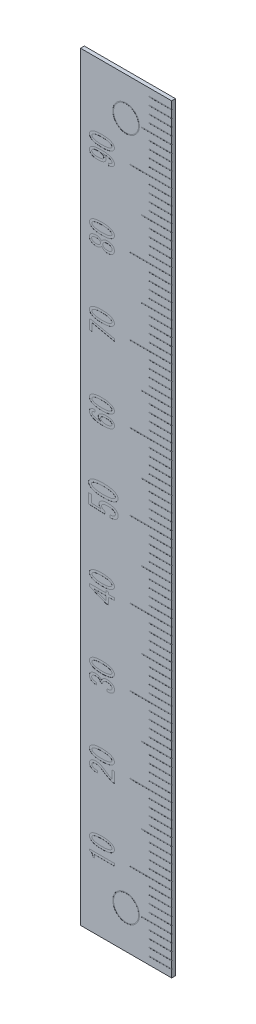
SolidWorks part; units mm, degrees
ref_plane "Front" through (0, 0, 0) normal (0, 0, 1) x (1, 0, 0)
ref_plane "Top" through (0, 0, 0) normal (0, 1, 0) x (1, 0, 0)
ref_plane "Right" through (0, 0, 0) normal (1, 0, 0) x (0, 0, -1)
sketch "Sketch1" plane through (0, 0, 0) normal (0, 0, 1) x (1, 0, 0)
  line L1 (0, 0) -> (0, 100)
  line L2 (0, 0) -> (12, 0)
  line L3 (12, 0) -> (12, 100)
  line L4 (0, 100) -> (12, 100)
  dimension "D1" = 100
  dimension "D2" = 12
extrude "Extrude1" add sketch "Sketch1" along normal blind 0.5
sketch "Sketch2" plane through (0, 0, 0.5) normal (0, 0, 1) x (1, 0, 0)
  line L0 (0, 100) -> (0, 0) construction
  line L1 (0, 0) -> (12, 0) construction
  line L2 (12, 100) -> (0, 100) construction
  circle A0 centre (6, 5) radius 1.75
  circle A1 centre (6, 95) radius 1.75
  circle A2 centre (6, 5) radius 1.65
  circle A3 centre (6, 95) radius 1.65
  dimension "D1" = 6
  dimension "D2" = 6
  dimension "D3" = 5
  dimension "D4" = 5
  dimension "D5" = 3.5
  dimension "D6" = 3.5
  dimension "D7" = 0.1
extrude "Extrude2" cut sketch "Sketch2" against normal blind 0.01
sketch "Sketch3" plane through (0, 0, 0.5) normal (0, 0, 1) x (1, 0, 0)
  line L0 (12, 100) -> (0, 100) construction
  line L1 (1, 88.25) -> (4.5, 88.25) construction
  line L2 (1, 88.25) -> (1, 91.75) construction
  line L3 (1, 91.75) -> (4.5, 91.75) construction
  line L4 (4.5, 88.25) -> (4.5, 91.75) construction
  line L5 (0, 100) -> (0, 0) construction
  line L6 (4.5, 78.25) -> (4.5, 81.75) construction
  line L7 (4.5, 68.25) -> (4.5, 71.75) construction
  line L8 (4.5, 58.25) -> (4.5, 61.75) construction
  line L9 (5, 48.25) -> (5, 51.75) construction
  line L10 (4.5, 38.25) -> (4.5, 41.75) construction
  line L11 (4.5, 28.25) -> (4.5, 31.75) construction
  line L12 (4.5, 18.25) -> (4.5, 21.75) construction
  line L13 (4.5, 8.25) -> (4.5, 11.75) construction
  line L14 (12, 0) -> (12, 100) construction
  text T0 "90" font "ＭＳ ゴシック" height in points 11
  text T1 "80  " font "ＭＳ ゴシック" height in points 11
  text T2 "70" font "ＭＳ ゴシック" height in points 11
  text T3 "60" font "ＭＳ ゴシック" height in points 11
  text T4 "50" font "ＭＳ ゴシック" height in points 13
  text T5 "40  " font "ＭＳ ゴシック" height in points 11
  text T6 "30" font "ＭＳ ゴシック" height in points 11
  text T7 "20" font "ＭＳ ゴシック" height in points 11
  text T8 "10" font "ＭＳ ゴシック" height in points 11
  point P4 (4.5, 90)
  dimension "D1" = 3.5
  dimension "D2" = 10
  dimension "D3" = 1
  dimension "D4" = 3.5
  dimension "D6" = 7
  dimension "D5" = 4
extrude "Extrude3" cut sketch "Sketch3" against normal blind 0.01
sketch "Sketch4" plane through (0, 0, 0.5) normal (0, 0, 1) x (1, 0, 0)
  line L0 (12, 90.05) -> (6.5, 90.05)
  line L1 (12, 0) -> (12, 100) construction
  line L2 (6.5, 90.05) -> (6.5, 89.95)
  line L3 (6.5, 89.95) -> (12, 89.95)
  line L4 (12, 89.95) -> (12, 90.05)
  line L5 (12, 100) -> (0, 100) construction
  line L6 (12, 98.05) -> (12, 97.95)
  line L7 (12, 94.95) -> (8, 94.95)
  line L8 (12, 94.95) -> (12, 95.05)
  line L9 (12, 95.05) -> (8, 95.05)
  line L10 (8, 94.95) -> (8, 95.05)
  line L11 (12, 99.05) -> (9, 99.05)
  line L12 (12, 99.05) -> (12, 98.95)
  line L13 (12, 98.95) -> (9, 98.95)
  line L14 (9, 99.05) -> (9, 98.95)
  line L15 (12, 98.05) -> (9, 98.05)
  line L16 (12, 97.95) -> (9, 97.95)
  line L17 (9, 98.05) -> (9, 97.95)
  line L18 (12, 97.05) -> (12, 96.95)
  line L19 (12, 97.05) -> (9, 97.05)
  line L20 (12, 96.95) -> (9, 96.95)
  line L21 (9, 97.05) -> (9, 96.95)
  line L22 (12, 96.05) -> (12, 95.95)
  line L23 (12, 96.05) -> (9, 96.05)
  line L24 (12, 95.95) -> (9, 95.95)
  line L25 (9, 96.05) -> (9, 95.95)
  line L26 (12, 80.05) -> (6.5, 80.05)
  line L27 (6.5, 80.05) -> (6.5, 79.95)
  line L28 (6.5, 79.95) -> (12, 79.95)
  line L29 (12, 79.95) -> (12, 80.05)
  line L30 (12, 94.05) -> (12, 93.95)
  line L31 (12, 94.05) -> (9, 94.05)
  line L32 (12, 93.95) -> (9, 93.95)
  line L33 (9, 94.05) -> (9, 93.95)
  line L34 (12, 93.05) -> (12, 92.95)
  line L35 (12, 93.05) -> (9, 93.05)
  line L36 (12, 92.95) -> (9, 92.95)
  line L37 (9, 93.05) -> (9, 92.95)
  line L38 (12, 92.05) -> (12, 91.95)
  line L39 (12, 92.05) -> (9, 92.05)
  line L40 (12, 91.95) -> (9, 91.95)
  line L41 (9, 92.05) -> (9, 91.95)
  line L42 (12, 91.05) -> (12, 90.95)
  line L43 (12, 91.05) -> (9, 91.05)
  line L44 (12, 90.95) -> (9, 90.95)
  line L45 (9, 91.05) -> (9, 90.95)
  line L46 (9, 95.05) -> (9, 94.95)
  line L47 (12, 95.05) -> (9, 95.05)
  line L48 (12, 94.95) -> (9, 94.95)
  line L49 (12, 95.05) -> (12, 94.95)
  line L50 (12, 88.05) -> (12, 87.95)
  line L51 (12, 84.95) -> (8, 84.95)
  line L52 (12, 84.95) -> (12, 85.05)
  line L53 (12, 85.05) -> (8, 85.05)
  line L54 (8, 84.95) -> (8, 85.05)
  line L55 (12, 89.05) -> (9, 89.05)
  line L56 (12, 89.05) -> (12, 88.95)
  line L57 (12, 88.95) -> (9, 88.95)
  line L58 (9, 89.05) -> (9, 88.95)
  line L59 (12, 88.05) -> (9, 88.05)
  line L60 (12, 87.95) -> (9, 87.95)
  line L61 (9, 88.05) -> (9, 87.95)
  line L62 (12, 87.05) -> (12, 86.95)
  line L63 (12, 87.05) -> (9, 87.05)
  line L64 (12, 86.95) -> (9, 86.95)
  line L65 (9, 87.05) -> (9, 86.95)
  line L66 (12, 86.05) -> (12, 85.95)
  line L67 (12, 86.05) -> (9, 86.05)
  line L68 (12, 85.95) -> (9, 85.95)
  line L69 (9, 86.05) -> (9, 85.95)
  line L70 (12, 84.05) -> (12, 83.95)
  line L71 (12, 84.05) -> (9, 84.05)
  line L72 (12, 83.95) -> (9, 83.95)
  line L73 (9, 84.05) -> (9, 83.95)
  line L74 (12, 83.05) -> (12, 82.95)
  line L75 (12, 83.05) -> (9, 83.05)
  line L76 (12, 82.95) -> (9, 82.95)
  line L77 (9, 83.05) -> (9, 82.95)
  line L78 (12, 82.05) -> (12, 81.95)
  line L79 (12, 82.05) -> (9, 82.05)
  line L80 (12, 81.95) -> (9, 81.95)
  line L81 (9, 82.05) -> (9, 81.95)
  line L82 (12, 81.05) -> (12, 80.95)
  line L83 (12, 81.05) -> (9, 81.05)
  line L84 (12, 80.95) -> (9, 80.95)
  line L85 (9, 81.05) -> (9, 80.95)
  line L86 (12, 70.05) -> (6.5, 70.05)
  line L87 (6.5, 70.05) -> (6.5, 69.95)
  line L88 (6.5, 69.95) -> (12, 69.95)
  line L89 (12, 69.95) -> (12, 70.05)
  line L90 (12, 78.05) -> (12, 77.95)
  line L91 (12, 74.95) -> (8, 74.95)
  line L92 (12, 74.95) -> (12, 75.05)
  line L93 (12, 75.05) -> (8, 75.05)
  line L94 (8, 74.95) -> (8, 75.05)
  line L95 (12, 79.05) -> (9, 79.05)
  line L96 (12, 79.05) -> (12, 78.95)
  line L97 (12, 78.95) -> (9, 78.95)
  line L98 (9, 79.05) -> (9, 78.95)
  line L99 (12, 78.05) -> (9, 78.05)
  line L100 (12, 77.95) -> (9, 77.95)
  line L101 (9, 78.05) -> (9, 77.95)
  line L102 (12, 77.05) -> (12, 76.95)
  line L103 (12, 77.05) -> (9, 77.05)
  line L104 (12, 76.95) -> (9, 76.95)
  line L105 (9, 77.05) -> (9, 76.95)
  line L106 (12, 76.05) -> (12, 75.95)
  line L107 (12, 76.05) -> (9, 76.05)
  line L108 (12, 75.95) -> (9, 75.95)
  line L109 (9, 76.05) -> (9, 75.95)
  line L110 (12, 74.05) -> (12, 73.95)
  line L111 (12, 74.05) -> (9, 74.05)
  line L112 (12, 73.95) -> (9, 73.95)
  line L113 (9, 74.05) -> (9, 73.95)
  line L114 (12, 73.05) -> (12, 72.95)
  line L115 (12, 73.05) -> (9, 73.05)
  line L116 (12, 72.95) -> (9, 72.95)
  line L117 (9, 73.05) -> (9, 72.95)
  line L118 (12, 72.05) -> (12, 71.95)
  line L119 (12, 72.05) -> (9, 72.05)
  line L120 (12, 71.95) -> (9, 71.95)
  line L121 (9, 72.05) -> (9, 71.95)
  line L122 (12, 71.05) -> (12, 70.95)
  line L123 (12, 71.05) -> (9, 71.05)
  line L124 (12, 70.95) -> (9, 70.95)
  line L125 (9, 71.05) -> (9, 70.95)
  line L126 (12, 60.05) -> (6.5, 60.05)
  line L127 (6.5, 60.05) -> (6.5, 59.95)
  line L128 (6.5, 59.95) -> (12, 59.95)
  line L129 (12, 59.95) -> (12, 60.05)
  line L130 (12, 68.05) -> (12, 67.95)
  line L131 (12, 64.95) -> (8, 64.95)
  line L132 (12, 64.95) -> (12, 65.05)
  line L133 (12, 65.05) -> (8, 65.05)
  line L134 (8, 64.95) -> (8, 65.05)
  line L135 (12, 69.05) -> (9, 69.05)
  line L136 (12, 69.05) -> (12, 68.95)
  line L137 (12, 68.95) -> (9, 68.95)
  line L138 (9, 69.05) -> (9, 68.95)
  line L139 (12, 68.05) -> (9, 68.05)
  line L140 (12, 67.95) -> (9, 67.95)
  line L141 (9, 68.05) -> (9, 67.95)
  line L142 (12, 67.05) -> (12, 66.95)
  line L143 (12, 67.05) -> (9, 67.05)
  line L144 (12, 66.95) -> (9, 66.95)
  line L145 (9, 67.05) -> (9, 66.95)
  line L146 (12, 66.05) -> (12, 65.95)
  line L147 (12, 66.05) -> (9, 66.05)
  line L148 (12, 65.95) -> (9, 65.95)
  line L149 (9, 66.05) -> (9, 65.95)
  line L150 (12, 64.05) -> (12, 63.95)
  line L151 (12, 64.05) -> (9, 64.05)
  line L152 (12, 63.95) -> (9, 63.95)
  line L153 (9, 64.05) -> (9, 63.95)
  line L154 (12, 63.05) -> (12, 62.95)
  line L155 (12, 63.05) -> (9, 63.05)
  line L156 (12, 62.95) -> (9, 62.95)
  line L157 (9, 63.05) -> (9, 62.95)
  line L158 (12, 62.05) -> (12, 61.95)
  line L159 (12, 62.05) -> (9, 62.05)
  line L160 (12, 61.95) -> (9, 61.95)
  line L161 (9, 62.05) -> (9, 61.95)
  line L162 (12, 61.05) -> (12, 60.95)
  line L163 (12, 61.05) -> (9, 61.05)
  line L164 (12, 60.95) -> (9, 60.95)
  line L165 (9, 61.05) -> (9, 60.95)
  line L166 (12, 50.05) -> (6.5, 50.05)
  line L167 (6.5, 50.05) -> (6.5, 49.95)
  line L168 (6.5, 49.95) -> (12, 49.95)
  line L169 (12, 49.95) -> (12, 50.05)
  line L170 (12, 58.05) -> (12, 57.95)
  line L171 (12, 54.95) -> (8, 54.95)
  line L172 (12, 54.95) -> (12, 55.05)
  line L173 (12, 55.05) -> (8, 55.05)
  line L174 (8, 54.95) -> (8, 55.05)
  line L175 (12, 59.05) -> (9, 59.05)
  line L176 (12, 59.05) -> (12, 58.95)
  line L177 (12, 58.95) -> (9, 58.95)
  line L178 (9, 59.05) -> (9, 58.95)
  line L179 (12, 58.05) -> (9, 58.05)
  line L180 (12, 57.95) -> (9, 57.95)
  line L181 (9, 58.05) -> (9, 57.95)
  line L182 (12, 57.05) -> (12, 56.95)
  line L183 (12, 57.05) -> (9, 57.05)
  line L184 (12, 56.95) -> (9, 56.95)
  line L185 (9, 57.05) -> (9, 56.95)
  line L186 (12, 56.05) -> (12, 55.95)
  line L187 (12, 56.05) -> (9, 56.05)
  line L188 (12, 55.95) -> (9, 55.95)
  line L189 (9, 56.05) -> (9, 55.95)
  line L190 (12, 54.05) -> (12, 53.95)
  line L191 (12, 54.05) -> (9, 54.05)
  line L192 (12, 53.95) -> (9, 53.95)
  line L193 (9, 54.05) -> (9, 53.95)
  line L194 (12, 53.05) -> (12, 52.95)
  line L195 (12, 53.05) -> (9, 53.05)
  line L196 (12, 52.95) -> (9, 52.95)
  line L197 (9, 53.05) -> (9, 52.95)
  line L198 (12, 52.05) -> (12, 51.95)
  line L199 (12, 52.05) -> (9, 52.05)
  line L200 (12, 51.95) -> (9, 51.95)
  line L201 (9, 52.05) -> (9, 51.95)
  line L202 (12, 51.05) -> (12, 50.95)
  line L203 (12, 51.05) -> (9, 51.05)
  line L204 (12, 50.95) -> (9, 50.95)
  line L205 (9, 51.05) -> (9, 50.95)
  line L206 (12, 50.05) -> (6.5, 50.05)
  line L207 (6.5, 50.05) -> (6.5, 49.95)
  line L208 (6.5, 49.95) -> (12, 49.95)
  line L209 (12, 49.95) -> (12, 50.05)
  line L210 (12, 48.05) -> (12, 47.95)
  line L211 (12, 44.95) -> (8, 44.95)
  line L212 (12, 44.95) -> (12, 45.05)
  line L213 (12, 45.05) -> (8, 45.05)
  line L214 (8, 44.95) -> (8, 45.05)
  line L215 (12, 49.05) -> (9, 49.05)
  line L216 (12, 49.05) -> (12, 48.95)
  line L217 (12, 48.95) -> (9, 48.95)
  line L218 (9, 49.05) -> (9, 48.95)
  line L219 (12, 48.05) -> (9, 48.05)
  line L220 (12, 47.95) -> (9, 47.95)
  line L221 (9, 48.05) -> (9, 47.95)
  line L222 (12, 47.05) -> (12, 46.95)
  line L223 (12, 47.05) -> (9, 47.05)
  line L224 (12, 46.95) -> (9, 46.95)
  line L225 (9, 47.05) -> (9, 46.95)
  line L226 (12, 46.05) -> (12, 45.95)
  line L227 (12, 46.05) -> (9, 46.05)
  line L228 (12, 45.95) -> (9, 45.95)
  line L229 (9, 46.05) -> (9, 45.95)
  line L230 (12, 44.05) -> (12, 43.95)
  line L231 (12, 44.05) -> (9, 44.05)
  line L232 (12, 43.95) -> (9, 43.95)
  line L233 (9, 44.05) -> (9, 43.95)
  line L234 (12, 43.05) -> (12, 42.95)
  line L235 (12, 43.05) -> (9, 43.05)
  line L236 (12, 42.95) -> (9, 42.95)
  line L237 (9, 43.05) -> (9, 42.95)
  line L238 (12, 42.05) -> (12, 41.95)
  line L239 (12, 42.05) -> (9, 42.05)
  line L240 (12, 41.95) -> (9, 41.95)
  line L241 (9, 42.05) -> (9, 41.95)
  line L242 (12, 41.05) -> (12, 40.95)
  line L243 (12, 41.05) -> (9, 41.05)
  line L244 (12, 40.95) -> (9, 40.95)
  line L245 (9, 41.05) -> (9, 40.95)
  line L246 (12, 40.05) -> (6.5, 40.05)
  line L247 (6.5, 40.05) -> (6.5, 39.95)
  line L248 (6.5, 39.95) -> (12, 39.95)
  line L249 (12, 39.95) -> (12, 40.05)
  line L250 (12, 38.05) -> (12, 37.95)
  line L251 (12, 34.95) -> (8, 34.95)
  line L252 (12, 34.95) -> (12, 35.05)
  line L253 (12, 35.05) -> (8, 35.05)
  line L254 (8, 34.95) -> (8, 35.05)
  line L255 (12, 39.05) -> (9, 39.05)
  line L256 (12, 39.05) -> (12, 38.95)
  line L257 (12, 38.95) -> (9, 38.95)
  line L258 (9, 39.05) -> (9, 38.95)
  line L259 (12, 38.05) -> (9, 38.05)
  line L260 (12, 37.95) -> (9, 37.95)
  line L261 (9, 38.05) -> (9, 37.95)
  line L262 (12, 37.05) -> (12, 36.95)
  line L263 (12, 37.05) -> (9, 37.05)
  line L264 (12, 36.95) -> (9, 36.95)
  line L265 (9, 37.05) -> (9, 36.95)
  line L266 (12, 36.05) -> (12, 35.95)
  line L267 (12, 36.05) -> (9, 36.05)
  line L268 (12, 35.95) -> (9, 35.95)
  line L269 (9, 36.05) -> (9, 35.95)
  line L270 (12, 34.05) -> (12, 33.95)
  line L271 (12, 34.05) -> (9, 34.05)
  line L272 (12, 33.95) -> (9, 33.95)
  line L273 (9, 34.05) -> (9, 33.95)
  line L274 (12, 33.05) -> (12, 32.95)
  line L275 (12, 33.05) -> (9, 33.05)
  line L276 (12, 32.95) -> (9, 32.95)
  line L277 (9, 33.05) -> (9, 32.95)
  line L278 (12, 32.05) -> (12, 31.95)
  line L279 (12, 32.05) -> (9, 32.05)
  line L280 (12, 31.95) -> (9, 31.95)
  line L281 (9, 32.05) -> (9, 31.95)
  line L282 (12, 31.05) -> (12, 30.95)
  line L283 (12, 31.05) -> (9, 31.05)
  line L284 (12, 30.95) -> (9, 30.95)
  line L285 (9, 31.05) -> (9, 30.95)
  line L286 (12, 30.05) -> (6.5, 30.05)
  line L287 (6.5, 30.05) -> (6.5, 29.95)
  line L288 (6.5, 29.95) -> (12, 29.95)
  line L289 (12, 29.95) -> (12, 30.05)
  line L290 (12, 28.05) -> (12, 27.95)
  line L291 (12, 24.95) -> (8, 24.95)
  line L292 (12, 24.95) -> (12, 25.05)
  line L293 (12, 25.05) -> (8, 25.05)
  line L294 (8, 24.95) -> (8, 25.05)
  line L295 (12, 29.05) -> (9, 29.05)
  line L296 (12, 29.05) -> (12, 28.95)
  line L297 (12, 28.95) -> (9, 28.95)
  line L298 (9, 29.05) -> (9, 28.95)
  line L299 (12, 28.05) -> (9, 28.05)
  line L300 (12, 27.95) -> (9, 27.95)
  line L301 (9, 28.05) -> (9, 27.95)
  line L302 (12, 27.05) -> (12, 26.95)
  line L303 (12, 27.05) -> (9, 27.05)
  line L304 (12, 26.95) -> (9, 26.95)
  line L305 (9, 27.05) -> (9, 26.95)
  line L306 (12, 26.05) -> (12, 25.95)
  line L307 (12, 26.05) -> (9, 26.05)
  line L308 (12, 25.95) -> (9, 25.95)
  line L309 (9, 26.05) -> (9, 25.95)
  line L310 (12, 24.05) -> (12, 23.95)
  line L311 (12, 24.05) -> (9, 24.05)
  line L312 (12, 23.95) -> (9, 23.95)
  line L313 (9, 24.05) -> (9, 23.95)
  line L314 (12, 23.05) -> (12, 22.95)
  line L315 (12, 23.05) -> (9, 23.05)
  line L316 (12, 22.95) -> (9, 22.95)
  line L317 (9, 23.05) -> (9, 22.95)
  line L318 (12, 22.05) -> (12, 21.95)
  line L319 (12, 22.05) -> (9, 22.05)
  line L320 (12, 21.95) -> (9, 21.95)
  line L321 (9, 22.05) -> (9, 21.95)
  line L322 (12, 21.05) -> (12, 20.95)
  line L323 (12, 21.05) -> (9, 21.05)
  line L324 (12, 20.95) -> (9, 20.95)
  line L325 (9, 21.05) -> (9, 20.95)
  line L326 (12, 20.05) -> (6.5, 20.05)
  line L327 (6.5, 20.05) -> (6.5, 19.95)
  line L328 (6.5, 19.95) -> (12, 19.95)
  line L329 (12, 19.95) -> (12, 20.05)
  line L330 (12, 18.05) -> (12, 17.95)
  line L331 (12, 14.95) -> (8, 14.95)
  line L332 (12, 14.95) -> (12, 15.05)
  line L333 (12, 15.05) -> (8, 15.05)
  line L334 (8, 14.95) -> (8, 15.05)
  line L335 (12, 19.05) -> (9, 19.05)
  line L336 (12, 19.05) -> (12, 18.95)
  line L337 (12, 18.95) -> (9, 18.95)
  line L338 (9, 19.05) -> (9, 18.95)
  line L339 (12, 18.05) -> (9, 18.05)
  line L340 (12, 17.95) -> (9, 17.95)
  line L341 (9, 18.05) -> (9, 17.95)
  line L342 (12, 17.05) -> (12, 16.95)
  line L343 (12, 17.05) -> (9, 17.05)
  line L344 (12, 16.95) -> (9, 16.95)
  line L345 (9, 17.05) -> (9, 16.95)
  line L346 (12, 16.05) -> (12, 15.95)
  line L347 (12, 16.05) -> (9, 16.05)
  line L348 (12, 15.95) -> (9, 15.95)
  line L349 (9, 16.05) -> (9, 15.95)
  line L350 (12, 14.05) -> (12, 13.95)
  line L351 (12, 14.05) -> (9, 14.05)
  line L352 (12, 13.95) -> (9, 13.95)
  line L353 (9, 14.05) -> (9, 13.95)
  line L354 (12, 13.05) -> (12, 12.95)
  line L355 (12, 13.05) -> (9, 13.05)
  line L356 (12, 12.95) -> (9, 12.95)
  line L357 (9, 13.05) -> (9, 12.95)
  line L358 (12, 12.05) -> (12, 11.95)
  line L359 (12, 12.05) -> (9, 12.05)
  line L360 (12, 11.95) -> (9, 11.95)
  line L361 (9, 12.05) -> (9, 11.95)
  line L362 (12, 11.05) -> (12, 10.95)
  line L363 (12, 11.05) -> (9, 11.05)
  line L364 (12, 10.95) -> (9, 10.95)
  line L365 (9, 11.05) -> (9, 10.95)
  line L366 (12, 10.05) -> (6.5, 10.05)
  line L367 (6.5, 10.05) -> (6.5, 9.95)
  line L368 (6.5, 9.95) -> (12, 9.95)
  line L369 (12, 9.95) -> (12, 10.05)
  line L370 (12, 8.05) -> (12, 7.95)
  line L371 (12, 4.95) -> (8, 4.95)
  line L372 (12, 4.95) -> (12, 5.05)
  line L373 (12, 5.05) -> (8, 5.05)
  line L374 (8, 4.95) -> (8, 5.05)
  line L375 (12, 9.05) -> (9, 9.05)
  line L376 (12, 9.05) -> (12, 8.95)
  line L377 (12, 8.95) -> (9, 8.95)
  line L378 (9, 9.05) -> (9, 8.95)
  line L379 (12, 8.05) -> (9, 8.05)
  line L380 (12, 7.95) -> (9, 7.95)
  line L381 (9, 8.05) -> (9, 7.95)
  line L382 (12, 7.05) -> (12, 6.95)
  line L383 (12, 7.05) -> (9, 7.05)
  line L384 (12, 6.95) -> (9, 6.95)
  line L385 (9, 7.05) -> (9, 6.95)
  line L386 (12, 6.05) -> (12, 5.95)
  line L387 (12, 6.05) -> (9, 6.05)
  line L388 (12, 5.95) -> (9, 5.95)
  line L389 (9, 6.05) -> (9, 5.95)
  line L390 (12, 4.05) -> (12, 3.95)
  line L391 (12, 4.05) -> (9, 4.05)
  line L392 (12, 3.95) -> (9, 3.95)
  line L393 (9, 4.05) -> (9, 3.95)
  line L394 (12, 3.05) -> (12, 2.95)
  line L395 (12, 3.05) -> (9, 3.05)
  line L396 (12, 2.95) -> (9, 2.95)
  line L397 (9, 3.05) -> (9, 2.95)
  line L398 (12, 2.05) -> (12, 1.95)
  line L399 (12, 2.05) -> (9, 2.05)
  line L400 (12, 1.95) -> (9, 1.95)
  line L401 (9, 2.05) -> (9, 1.95)
  line L402 (12, 1.05) -> (12, 0.95)
  line L403 (12, 1.05) -> (9, 1.05)
  line L404 (12, 0.95) -> (9, 0.95)
  line L405 (9, 1.05) -> (9, 0.95)
  point P4 (12, 90)
  point P13 (12, 95)
  point P18 (12, 99)
  dimension "D1" = 10
  dimension "D2" = 0.1
  dimension "D3" = 5.5
  dimension "D4" = 5
  dimension "D5" = 0.1
  dimension "D6" = 1
  dimension "D7" = 0.1
  dimension "D8" = 3
  dimension "D9" = 4
  dimension "D10" = 9
  dimension "D11" = 5
  dimension "D12" = 6
extrude "Extrude4" cut sketch "Sketch4" against normal blind 0.01
move or copy body "Body-Move/Copy2" bodies to move or copy 105 copy no translate (-12, -50, 0)
move or copy body "Body-Move/Copy3" bodies to move or copy 107 copy no translate (0, 50, 0)
